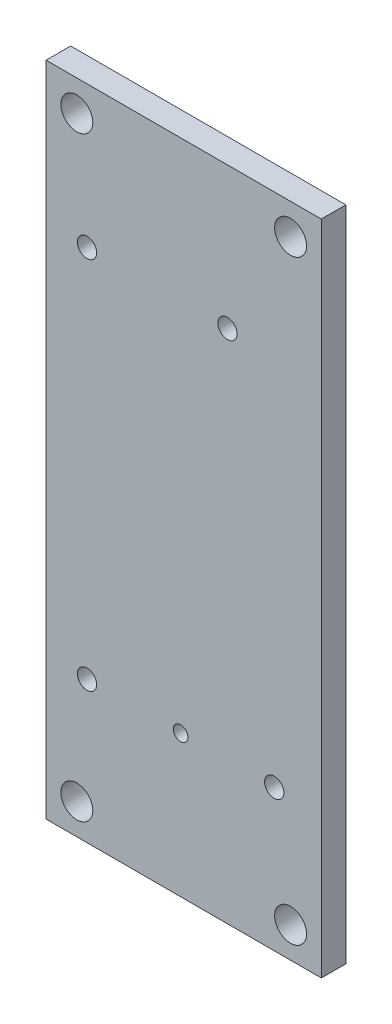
SolidWorks part; units mm, degrees
ref_plane "Front Plane" through (0, 0, 0) normal (0, 0, 1) x (1, 0, 0)
ref_plane "Top Plane" through (0, 0, 0) normal (0, 1, 0) x (1, 0, 0)
ref_plane "Right Plane" through (0, 0, 0) normal (1, 0, 0) x (0, 0, -1)
sketch "Sketch1" plane through (0, 0, 13.5624) normal (0, 0, -1) x (-1, 0, 0)
  line L1 (44.4131, -15.7531) -> (66.8131, -15.7531)
  line L2 (44.4131, -15.7531) -> (44.4131, 37.7469)
  line L3 (44.4131, 37.7469) -> (66.8131, 37.7469)
  line L4 (66.8131, -15.7531) -> (66.8131, 37.7469)
  line L6 (64.6156, 28.7469) -> (47.1156, 28.7469) construction
  circle A0 centre (52.0556, 26.2169) radius 0.785
  circle A1 centre (63.4856, 26.2169) radius 0.785
  circle A2 centre (48.2456, -4.2231) radius 0.785
  circle A3 centre (63.4856, -4.2231) radius 0.785
  circle A4 centre (55.8656, -4.2231) radius 0.5979
  dimension "D1" = 53.5
  dimension "D2" = 9
  dimension "D3" = 22.4
  dimension "D4" = 3.3275
extrude "Boss-Extrude1" add sketch "Sketch1" along normal blind 2
hole_wizard "M2.5 Clearance Hole1" positions "Sketch4" profile "Sketch3" hole size "M2.5" standard "ANSI Metric"
sketch "Sketch4" plane through (0, 0, 13.5624) normal (0, 0, 1) x (1, 0, 0)
  line L0 (-66.8131, -15.7531) -> (-66.8131, 37.7469) construction
  line L1 (-66.8131, 37.7469) -> (-44.4131, 37.7469) construction
  line L2 (-44.4131, -15.7531) -> (-66.8131, -15.7531) construction
  line L3 (-44.4131, 37.7469) -> (-44.4131, -15.7531) construction
  point P7 (-64.3131, 35.2469)
  point P9 (-46.9131, 35.2469)
  point P11 (-46.9131, -13.2531)
  point P13 (-64.3131, -13.2531)
  dimension "D1" = 2.5
  dimension "D2" = 2.5
  dimension "D3" = 2.5
  dimension "D4" = 2.5
  dimension "D5" = 2.5
  dimension "D6" = 2.5
  dimension "D7" = 2.5
  dimension "D8" = 2.5
sketch "Sketch3" plane through (-64.3131, 35.2469, 13.5624) normal (1, 0, 0) x (0, -1, 0)
  line L0 (0, 0) -> (0, 2)
  line L1 (0, 2) -> (1.3, 2)
  line L2 (1.3, 2) -> (1.3, 0)
  line L5 (1.3, 0) -> (0, 0)
  line L11 (0, -6.35) -> (0, 107.95) construction
  dimension "Thru Hole Dia." = 2.6
  dimension "Thru Hole Depth" = 2
